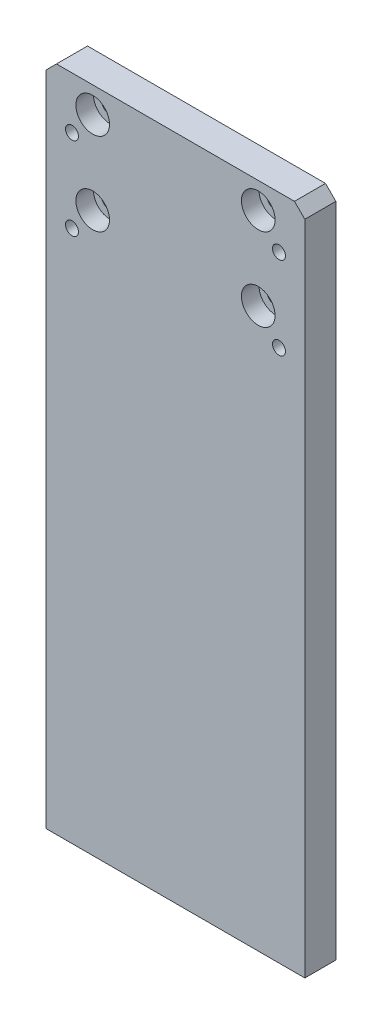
SolidWorks part; units mm, degrees
ref_plane "Front Plane" through (0, 0, 0) normal (0, 0, 1) x (1, 0, 0)
ref_plane "Top Plane" through (0, 0, 0) normal (0, 1, 0) x (1, 0, 0)
ref_plane "Right Plane" through (0, 0, 0) normal (1, 0, 0) x (0, 0, -1)
sketch "Sketch1" plane through (0, 0, 0) normal (0, 0, 1) x (1, 0, 0)
  line L0 (0, -3.3) -> (0, 3.3) construction
  line L1 (-25, 129) -> (25, 129)
  line L2 (-25, 129) -> (-25, 0)
  line L3 (-25, 0) -> (25, 0)
  line L4 (25, 129) -> (25, 0)
  line L5 (-25, 129) -> (25, 0) construction
  line L6 (-25, 0) -> (25, 129) construction
  line L7 (3.3, 0) -> (-3.3, 0) construction
  point P0 (0, 64.5)
  dimension "D1" = 129
  dimension "D3" = 50
extrude "Extrude1" add sketch "Sketch1" along normal mid plane 6
hole_wizard "CBORE for M3 Hex Socket Head Cap Screw1" positions "Sketch3" profile "Sketch2" counterbore size "M3" standard "Iso"
sketch "Sketch3" plane through (0, 0, 3) normal (0, 0, 1) x (1, 0, 0)
  line L1 (-16, 124) -> (16, 124) construction
  line L2 (-16, 124) -> (-16, 108) construction
  line L3 (-16, 108) -> (16, 108) construction
  line L4 (16, 124) -> (16, 108) construction
  line L5 (-16, 124) -> (16, 108) construction
  line L6 (-16, 108) -> (16, 124) construction
  line L7 (0, 124) -> (0, 116) construction
  line L9 (0, -3.3) -> (0, 3.3) construction
  line L10 (25, 129) -> (-25, 129) construction
  point P0 (-16, 108)
  point P3 (16, 124)
  point P4 (16, 108)
  point P23 (-16, 124)
  dimension "D1" = 16
  dimension "D2" = 32
  dimension "D3" = 5
sketch "Sketch2" plane through (-16, 108, 3) normal (1, 0, 0) x (0, -1, 0)
  line L0 (0, 0) -> (0, 6)
  line L1 (0, 6) -> (1.7, 6)
  line L3 (1.7, 6) -> (1.7, 3.4)
  line L4 (1.7, 3.4) -> (3.25, 3.4)
  line L5 (3.25, 3.4) -> (3.25, 0)
  line L7 (3.25, 0) -> (0, 0)
  line L11 (0, -6.35) -> (0, 107.95) construction
  dimension "通し穴の直径" = 3.4
  dimension "通し穴の深さ" = 6
  dimension "座ぐり穴の直径" = 6.5
  dimension "座ぐり穴の深さ" = 3.4
hole_wizard "M3 Tapped Hole1" positions "Sketch5" profile "Sketch4" tap size "M3" standard "Iso"
sketch "Sketch5" plane through (0, 0, 3) normal (0, 0, 1) x (1, 0, 0)
  line L1 (-20, 119) -> (20, 119) construction
  line L2 (-20, 119) -> (-20, 103) construction
  line L3 (-20, 103) -> (20, 103) construction
  line L4 (20, 119) -> (20, 103) construction
  line L5 (-20, 119) -> (20, 103) construction
  line L6 (-20, 103) -> (20, 119) construction
  line L7 (0, 111) -> (0, 103) construction
  line L9 (0, -3.3) -> (0, 3.3) construction
  line L10 (25, 129) -> (-25, 129) construction
  point P0 (-20, 119)
  point P3 (20, 119)
  point P25 (-20, 103)
  point P27 (20, 103)
  dimension "D1" = 10
  dimension "D2" = 16
  dimension "D3" = 40
sketch "Sketch4" plane through (-20, 119, 3) normal (1, 0, 0) x (0, -1, 0)
  line L0 (0, 0) -> (0, 6)
  line L1 (0, 6) -> (1.25, 6)
  line L2 (1.25, 6) -> (1.25, 0)
  line L5 (1.25, 0) -> (0, 0)
  line L11 (0, -6.35) -> (0, 107.95) construction
  dimension "次ｻｰﾌｪｽまでのねじ下穴ﾄﾞﾘﾙ直径" = 2.5
  dimension "次ｻｰﾌｪｽまでのねじ下穴ﾄﾞﾘﾙの深さ" = 6
hole_wizard "HoleWzd1" positions "Sketch7" profile "Sketch6" legacy
sketch "Sketch7" plane through (0, 0, 3) normal (0, 0, 1) x (1, 0, 0)
  point P0 (-16, 124)
  point P2 (16, 108)
  point P4 (16, 124)
  point P6 (-16, 108)
sketch "Sketch6" plane through (-16, 124, 3) normal (1, 0, 0) x (0, -1, 0)
  line L0 (0, 0) -> (0, 6)
  line L1 (0, 6) -> (1.75, 6)
  line L2 (1.75, 6) -> (1.75, 0)
  line L3 (1.75, 0) -> (0, 0)
  line L4 (0, 110) -> (0, -10) construction
  dimension "直径" = 3.5
  dimension "深さ" = 6
hole_wizard "M4 Tapped Hole1" positions "Sketch9" profile "Sketch8" tap size "M4" standard "Iso"
sketch "Sketch9" plane through (0, 0, 0) normal (0, -1, 0) x (-1, 0, 0)
  line L0 (-20, 0) -> (20, 0) construction
  point P0 (-20, 0)
  point P2 (20, 0)
  dimension "D1" = 40
sketch "Sketch8" plane through (20, 0, 0) normal (1, 0, 0) x (0, 0, -1)
  line L0 (0, 0) -> (0, 12.4914)
  line L1 (0, 12.4914) -> (1.65, 11.5)
  line L2 (1.65, 11.5) -> (1.65, 0)
  line L5 (1.65, 0) -> (0, 0)
  line L10 (0, 12.4914) -> (-1.65, 11.5) construction
  line L11 (0, -6.35) -> (0, 107.95) construction
  dimension "ねじ下穴ﾄﾞﾘﾙ直径" = 3.3
  dimension "ねじ下穴ﾄﾞﾘﾙの深さ" = 11.5
  dimension "ﾄﾞﾘﾙ角度" = 118
chamfer "Chamfer1" distance 2 angle 45 2 edges at (-25, 129, 0) (25, 129, 0)
